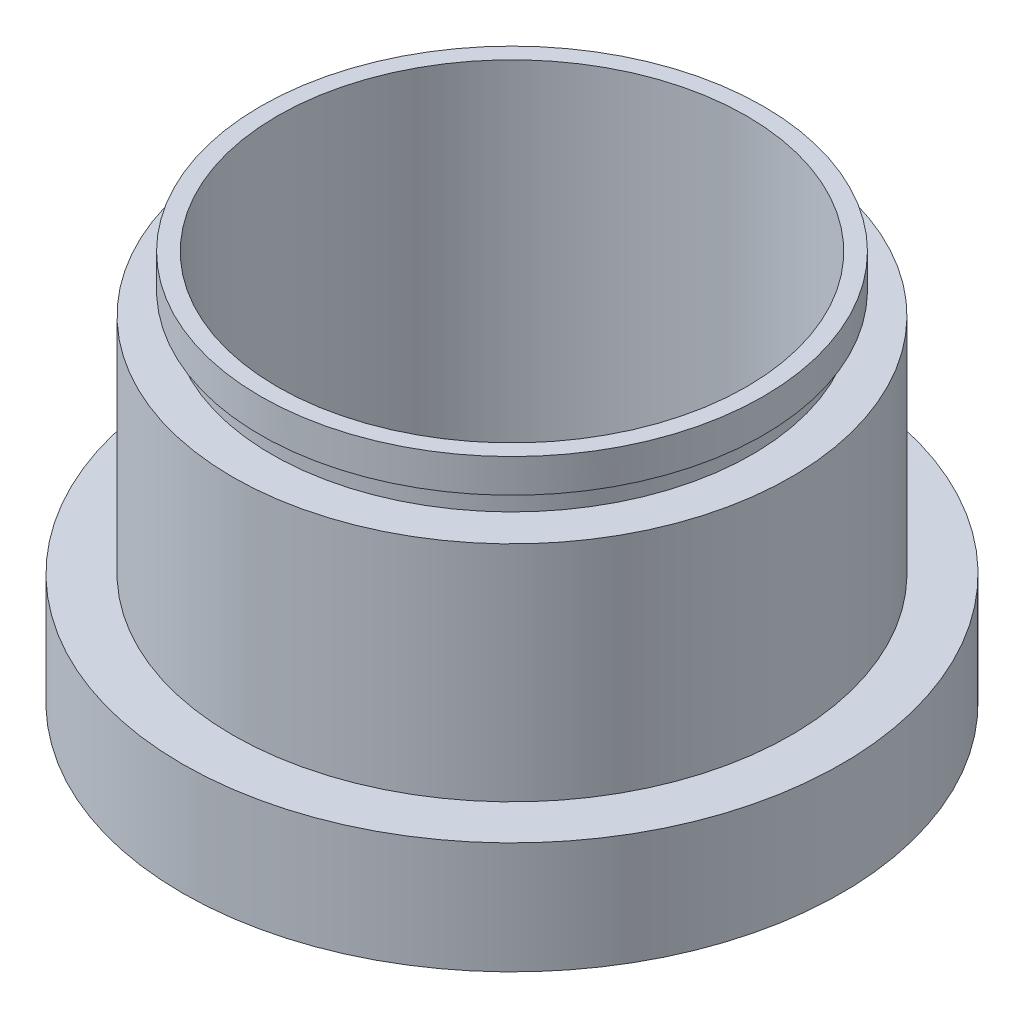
SolidWorks part; units mm, degrees
ref_plane "Front Plane" through (0, 0, 0) normal (0, 0, 1) x (1, 0, 0)
ref_plane "Top Plane" through (0, 0, 0) normal (0, 1, 0) x (1, 0, 0)
ref_plane "Right Plane" through (0, 0, 0) normal (1, 0, 0) x (0, 0, -1)
sketch "Sketch1" plane through (0, 0, 0) normal (0, 1, 0) x (1, 0, 0)
  circle A0 centre (0, 0) radius 29.5
  dimension "D1" = 59
extrude "Boss-Extrude1" add sketch "Sketch1" along normal blind 10
sketch "Sketch2" plane through (0, 10, 0) normal (0, 1, 0) x (1, 0, 0)
  circle A0 centre (0, 0) radius 25
  dimension "D1" = 50
extrude "Boss-Extrude2" add sketch "Sketch2" along normal blind 20
sketch "Sketch3" plane through (0, 30, 0) normal (0, 1, 0) x (1, 0, 0)
  circle A0 centre (0, 0) radius 22.5
  dimension "D1" = 45
extrude "Boss-Extrude3" add sketch "Sketch3" along normal blind 5
sketch "Sketch4" plane through (0, 35, 0) normal (0, 1, 0) x (1, 0, 0)
  circle A0 centre (0, 0) radius 21
  dimension "D1" = 42
extrude "Cut-Extrude1" cut sketch "Sketch4" against normal through all
sketch "Sketch5" plane through (0, 0, 0) normal (1, 0, 0) x (0, 0, -1)
  line L0 (0, 0) -> (0, 38.6594) construction
  line L1 (-22.5, 30) -> (-21.5, 30)
  line L2 (-22.5, 30) -> (-22.5, 32)
  line L3 (-22.5, 32) -> (-21.5, 32)
  line L4 (-21.5, 30) -> (-21.5, 32)
  dimension "D1" = 2
  dimension "D2" = 1
revolve "Cut-Revolve1" cut sketch "Sketch5" angle 360 about L0
